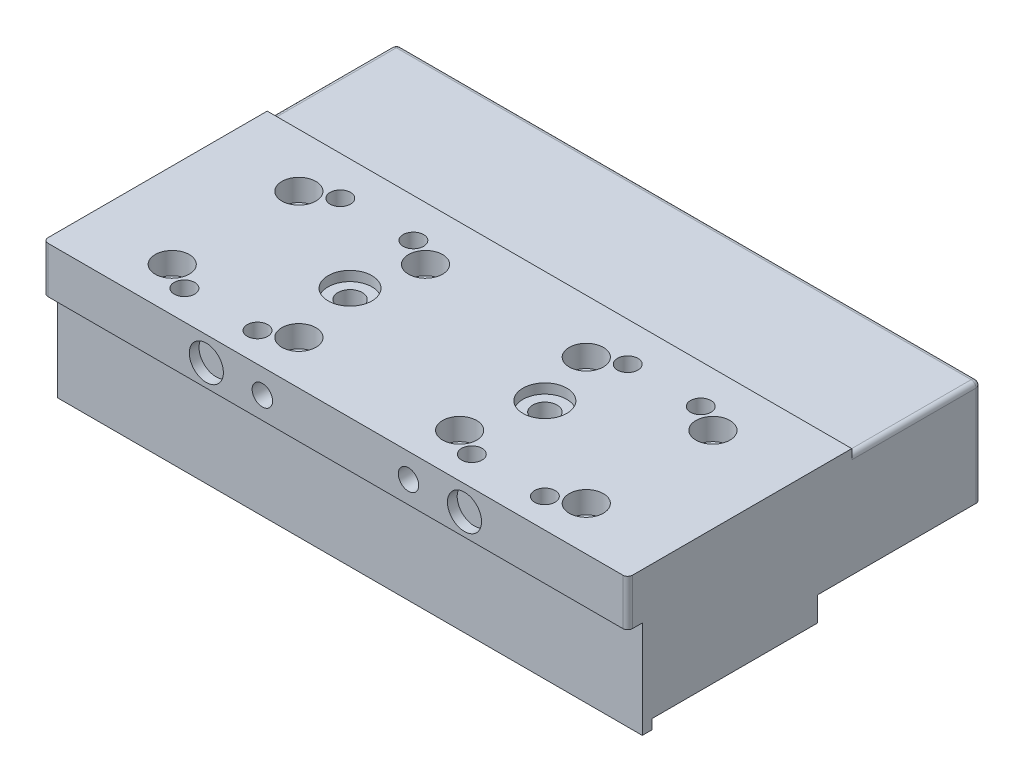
SolidWorks part; units mm, degrees
ref_plane "前视基准面" through (0, 0, 0) normal (0, 0, 1) x (1, 0, 0)
ref_plane "上视基准面" through (0, 0, 0) normal (0, 1, 0) x (1, 0, 0)
ref_plane "右视基准面" through (0, 0, 0) normal (1, 0, 0) x (0, 0, -1)
sketch "草图1" plane through (0, 0, 0) normal (0, 1, 0) x (1, 0, 0)
  line L1 (-60, 36.25) -> (60, 36.25)
  line L2 (-60, 36.25) -> (-60, -36.25)
  line L3 (-60, -36.25) -> (60, -36.25)
  line L4 (60, 36.25) -> (60, -36.25)
  line L5 (-60, 36.25) -> (60, -36.25) construction
  line L6 (-60, -36.25) -> (60, 36.25) construction
  point P0 (0, 0)
  dimension "D1" = 120
  dimension "D2" = 72.5
extrude "凸台-拉伸1" add sketch "草图1" along normal blind 22.5
sketch "草图2" plane through (0, 22.5, 0) normal (0, 1, 0) x (1, 0, 0)
  line L0 (60, -36.25) -> (60, 36.25) construction
  line L1 (-60, 36.25) -> (60, 36.25)
  line L2 (-60, 36.25) -> (-60, 9.75)
  line L3 (-60, 9.75) -> (60, 9.75)
  line L4 (60, 36.25) -> (60, 9.75)
  dimension "D1" = 26.5
extrude "切除-拉伸1" cut sketch "草图2" against normal blind 1
sketch "草图3" plane through (0, 0, 0) normal (0, -1, 0) x (1, 0, 0)
  line L0 (-60, -36.25) -> (-60, 36.25) construction
  line L1 (60, 36.25) -> (-60, 36.25)
  line L2 (60, 36.25) -> (60, -2.75)
  line L3 (60, -2.75) -> (-60, -2.75)
  line L4 (-60, 36.25) -> (-60, -2.75)
  dimension "D1" = 39
extrude "切除-拉伸2" cut sketch "草图3" against normal blind 13
sketch "草图4" plane through (-60, 0, 0) normal (-1, 0, 0) x (0, 0, 1)
  line L0 (-36.25, 21.5) -> (-9.75, 21.5) construction
  line L1 (-27.25, 3.3) -> (-25.35, 3.3)
  line L2 (-27.25, 3.3) -> (-27.25, 9.5)
  line L3 (-27.25, 9.5) -> (-8.25, 9.5)
  line L4 (-8.25, 3.3) -> (-8.25, 9.5)
  line L5 (-36.25, 21.5) -> (-36.25, 0) construction
  line L6 (-17.75, 3.5) -> (-17.75, -2.5913) construction
  line L7 (-36.25, 0) -> (-2.75, 0) construction
  line L8 (-25.35, 0) -> (-10.15, 0)
  line L9 (-25.35, 0) -> (-25.35, 3.3)
  line L11 (-10.15, 0) -> (-10.15, 3.3)
  line L12 (-10.15, 3.3) -> (-8.25, 3.3)
  dimension "D1" = 12
  dimension "D2" = 9
  dimension "D3" = 7.6
  dimension "D4" = 19
  dimension "D5" = 1.9
  dimension "D6" = 3.3
extrude "切除-拉伸3" [suppressed] cut sketch "草图4" against normal blind 30
sketch "草图36" plane through (-60, 0, 0) normal (-1, 0, 0) x (0, 0, 1)
  line L1 (-2.75, 13) -> (5.25, 13)
  line L2 (-2.75, 13) -> (-2.75, -5)
  line L3 (-2.75, -5) -> (5.25, -5)
  line L4 (5.25, 13) -> (5.25, -5)
  line L5 (36.25, 13) -> (-2.75, 13) construction
  line L6 (23.25, 13) -> (33.25, 13)
  line L7 (23.25, 13) -> (23.25, -5)
  line L8 (23.25, -5) -> (33.25, -5)
  line L10 (33.25, 13) -> (33.25, -5)
  dimension "D1" = 8
  dimension "D2" = 18
  dimension "D3" = 18
  dimension "D4" = 10
extrude "凸台-拉伸2" add sketch "草图36" against normal up to surface (120 mm away)
sketch "草图5" plane through (60, 0, 0) normal (1, 0, 0) x (0, 0, -1)
  line L0 (9.75, 21.5) -> (36.25, 21.5) construction
  line L1 (27.25, 9.5) -> (8.25, 9.5)
  line L2 (27.25, 9.5) -> (27.25, 3.3)
  line L3 (27.25, 3.3) -> (25.35, 3.3)
  line L4 (8.25, 9.5) -> (8.25, 3.3)
  line L5 (36.25, 21.5) -> (36.25, 0) construction
  line L7 (17.75, 3.5) -> (17.75, -3.6543) construction
  line L8 (2.75, 0) -> (36.25, 0) construction
  line L10 (25.35, 3.3) -> (25.35, 0)
  line L11 (25.35, 0) -> (10.15, 0)
  line L12 (10.15, 3.3) -> (10.15, 0)
  line L13 (10.15, 3.3) -> (8.25, 3.3)
  point P16 (26.3, 3.3)
  dimension "D1" = 3.3
  dimension "D2" = 19
  dimension "D3" = 12
  dimension "D4" = 9
  dimension "D5" = 7.6
  dimension "D6" = 1.9
  dimension "D7" = 1.9
extrude "切除-拉伸4" [suppressed] cut sketch "草图5" against normal blind 30
sketch "草图6" plane through (0, -5, 0) normal (0, -1, 0) x (1, 0, 0)
  line L0 (28.2, -27.15) -> (28.2, -2.15) construction
  line L1 (22.9, -27.15) -> (22.9, -2.15)
  line L2 (33.5, -27.15) -> (33.5, -2.15)
  line L3 (-28.2, -27.15) -> (-28.2, -2.15) construction
  line L4 (-33.5, -27.15) -> (-33.5, -2.15)
  line L5 (-22.9, -27.15) -> (-22.9, -2.15)
  line L6 (60, -36.25) -> (-60, -36.25) construction
  line L7 (60, -2.75) -> (60, -36.25) construction
  line L8 (-60, -36.25) -> (-60, -2.75) construction
  arc A0 (22.9, -27.15) -> (33.5, -27.15) centre (28.2, -27.15) ccw
  arc A1 (33.5, -2.15) -> (22.9, -2.15) centre (28.2, -2.15) ccw
  arc A2 (-33.5, -27.15) -> (-22.9, -27.15) centre (-28.2, -27.15) ccw
  arc A3 (-22.9, -2.15) -> (-33.5, -2.15) centre (-28.2, -2.15) ccw
  point P2 (28.2, -14.65)
  point P7 (-28.2, -14.65)
  dimension "D1" = 10.6
  dimension "D2" = 10.6
  dimension "D3" = 9.1
  dimension "D4" = 9.1
  dimension "D5" = 26.5
  dimension "D6" = 26.5
  dimension "D7" = 25
extrude "切除-拉伸5" [suppressed] cut sketch "草图6" against normal up to surface (14.5 mm away)
hole_wizard "打孔尺寸(%根据)内六角圆柱头螺钉的类型1" positions "草图7" profile "草图8" counterbore size "M4" standard "GB"
sketch "草图7" plane through (0, 22.5, 0) normal (0, 1, 0) x (1, 0, 0)
  line L0 (-60, -36.25) -> (60, -36.25) construction
  line L2 (0, -36.25) -> (0, 45.0705) construction
  point P0 (-42.5, -27.25)
  point P2 (-42.5, -1.25)
  point P4 (-16.5, -1.25)
  point P6 (-16.5, -27.25)
  point P8 (16.5, -1.25)
  point P10 (16.5, -27.25)
  point P12 (42.5, -27.25)
  point P14 (42.5, -1.25)
  dimension "D1" = 9
  dimension "D2" = 26
  dimension "D3" = 26
  dimension "D4" = 33
  dimension "D5" = 26
sketch "草图8" plane through (-42.5, 22.5, 27.25) normal (1, 0, 0) x (0, 0, 1)
  line L0 (0, 0) -> (0, 27.5)
  line L1 (0, 27.5) -> (2.25, 27.5)
  line L3 (2.25, 27.5) -> (2.25, 4.5)
  line L4 (2.25, 4.5) -> (3.5, 4.5)
  line L5 (3.5, 4.5) -> (3.5, 0)
  line L7 (3.5, 0) -> (0, 0)
  line L11 (0, -6.35) -> (0, 107.95) construction
  dimension "通孔孔直径" = 4.5
  dimension "通孔孔深度" = 27.5
  dimension "柱形沉头孔直径" = 7
  dimension "柱形沉头孔深度" = 4.5
hole_wizard "M4 螺纹孔1" positions "草图9" profile "草图10" tap size "M4" standard "GB"
sketch "草图9" plane through (0, 0, -36.25) normal (0, 0, -1) x (-1, 0, 0)
  line L0 (-60, 0) -> (60, 0) construction
  line L4 (0, 0) -> (0, 29.0588) construction
  line L5 (60, 22.5) -> (-60, 22.5) construction
  point P0 (-39, 6.5)
  point P2 (39, 6.5)
  dimension "D1" = 16
  dimension "D2" = 39
sketch "草图10" plane through (39, 6.5, -36.25) normal (1, 0, 0) x (0, 1, 0)
  line L0 (0, 0) -> (0, 11.9614)
  line L1 (0, 11.9614) -> (1.6, 11)
  line L2 (1.6, 11) -> (1.6, 0.425)
  line L3 (1.6, 0.425) -> (2.025, 0)
  line L5 (2.025, 0) -> (0, 0)
  line L6 (-1.6, 0.425) -> (-2.025, 0) construction
  line L10 (0, 11.9614) -> (-1.6, 11) construction
  line L11 (0, -6.35) -> (0, 107.95) construction
  dimension "螺纹孔钻头直径" = 3.2
  dimension "螺纹孔钻头深度" = 11
  dimension "近端锥形沉头孔直径" = 4.05
  dimension "近端锥形沉头孔角度" = 90
  dimension "导头角度" = 118
hole_wizard "M5 螺纹孔1" positions "草图11" profile "草图12" tap size "M5" standard "GB"
sketch "草图11" plane through (0, 0, -36.25) normal (0, 0, -1) x (-1, 0, 0)
  line L0 (-60, 21.5) -> (60, 21.5) construction
  line L1 (0, 21.5) -> (0, -5.4099) construction
  point P0 (-15, 17.5)
  point P2 (15, 17.5)
  dimension "D1" = 4
  dimension "D2" = 15
sketch "草图12" plane through (15, 17.5, -36.25) normal (1, 0, 0) x (0, 1, 0)
  line L0 (0, 0) -> (0, 15.7618)
  line L1 (0, 15.7618) -> (2.1, 14.5)
  line L2 (2.1, 14.5) -> (2.1, 0)
  line L5 (2.1, 0) -> (0, 0)
  line L10 (0, 15.7618) -> (-2.1, 14.5) construction
  line L11 (0, -6.35) -> (0, 107.95) construction
  dimension "螺纹孔钻头直径" = 4.2
  dimension "螺纹孔钻头深度" = 14.5
  dimension "导头角度" = 118
hole_wizard "M5 螺纹孔2" positions "草图15" profile "草图16" tap size "M5" standard "GB"
sketch "草图15" plane through (0, 22.5, 0) normal (0, 1, 0) x (1, 0, 0)
  line L0 (60, -36.25) -> (60, 9.75) construction
  line L1 (-60, -36.25) -> (60, -36.25) construction
  point P0 (-37, 1.75)
  point P2 (-22, 1.75)
  point P4 (22, 1.75)
  point P6 (37, 1.75)
  point P8 (37, -30.25)
  point P10 (22, -30.25)
  point P12 (-22, -30.25)
  point P14 (-37, -30.25)
  dimension "D1" = 23
  dimension "D2" = 6
  dimension "D3" = 32
  dimension "D4" = 15
  dimension "D5" = 44
  dimension "D6" = 15
sketch "草图16" plane through (-37, 22.5, -1.75) normal (1, 0, 0) x (0, 0, 1)
  line L0 (0, 0) -> (0, 11.2618)
  line L1 (0, 11.2618) -> (2.1, 10)
  line L2 (2.1, 10) -> (2.1, 0)
  line L5 (2.1, 0) -> (0, 0)
  line L10 (0, 11.2618) -> (-2.1, 10) construction
  line L11 (0, -6.35) -> (0, 107.95) construction
  dimension "螺纹孔钻头直径" = 4.2
  dimension "螺纹孔钻头深度" = 10
  dimension "导头角度" = 118
hole_wizard "M5 螺纹孔3" positions "草图19" profile "草图20" tap size "M5" standard "GB"
sketch "草图19" plane through (0, 0, 36.25) normal (0, 0, 1) x (1, 0, 0)
  line L0 (60, 13) -> (-60, 13) construction
  line L1 (0, 13) -> (0, 25.6962) construction
  point P0 (-15, 17.5)
  point P2 (15, 17.5)
  dimension "D1" = 4.5
  dimension "D2" = 15
sketch "草图20" plane through (-15, 17.5, 36.25) normal (1, 0, 0) x (0, -1, 0)
  line L0 (0, 0) -> (0, 5.7627)
  line L1 (0, 5.7627) -> (2.1, 5.2)
  line L2 (2.1, 5.2) -> (2.1, 0)
  line L5 (2.1, 0) -> (0, 0)
  line L10 (0, 5.7627) -> (-2.1, 5.2) construction
  line L11 (0, -6.35) -> (0, 107.95) construction
  dimension "螺纹孔钻头直径" = 4.2
  dimension "螺纹孔钻头深度" = 5.2
  dimension "导头角度" = 150
sketch "草图21" plane through (0, 0, 36.25) normal (0, 0, 1) x (1, 0, 0)
  line L0 (0, 13) -> (0, 27.1475) construction
  line L1 (60, 13) -> (-60, 13) construction
  circle A0 centre (-26.5, 17.5) radius 3.5
  circle A1 centre (26.5, 17.5) radius 3.5
  dimension "D1" = 53
  dimension "D3" = 7
  dimension "D2" = 26.5
extrude "切除-拉伸6" cut sketch "草图21" against normal blind 2
fillet "圆角1" radius 1 7 edges at (60, 10.75, -36.25) (60, 17.75, 36.25) (-60, 17.75, 36.25) (-60, 10.75, -36.25) (-60, 21.5, -23) (60, 21.5, -23) (0, 21.5, -36.25)
hole_wizard "M5 螺纹孔4" positions "草图22" profile "草图23" tap size "M5" standard "GB"
sketch "草图22" [suppressed] plane through (-22.9, 0, 0) normal (-1, 0, 0) x (0, 0, 1)
  line L1 (-27.15, 0) -> (-2.75, 0) construction
  line L3 (-17.75, 9.5) -> (-17.75, -9.4219) construction
  line L4 (-8.25, 9.5) -> (-27.25, 9.5) construction
  point P0 (-17.75, 3.5)
  dimension "D1" = 3.5
sketch "草图23" plane through (-22.9, 3.5, -17.75) normal (0, 1, 0) x (0, 0, 1)
  line L0 (0, 0) -> (0, 82.9)
  line L1 (0, 82.9) -> (2.1, 82.9)
  line L2 (2.1, 82.9) -> (2.1, 0)
  line L5 (2.1, 0) -> (0, 0)
  line L11 (0, -6.35) -> (0, 107.95) construction
  dimension "通孔螺纹孔钻头直径" = 4.2
  dimension "通孔螺纹孔钻头深度" = 82.9
sketch "草图31" plane through (0, 22.5, 0) normal (0, -1, 0) x (1, 0, 0)
  line L0 (0, 0) -> (0, 40.3044) construction
  line L1 (59, 36.25) -> (-59, 36.25) construction
  circle A0 centre (-20, 13.25) radius 4.5
  circle A1 centre (20, 13.25) radius 4.5
  dimension "D3" = 9
  dimension "D1" = 23
  dimension "D2" = 20
extrude "切除-拉伸7" cut sketch "草图31" along normal blind 2
hole_wizard "M6 螺纹孔1" positions "草图32" profile "草图33" tap size "M6" standard "GB"
sketch "草图32" plane through (0, 22.5, 0) normal (0, 1, 0) x (1, 0, 0)
  line L0 (0, 0) -> (0, -30.6645) construction
  line L2 (-59, -36.25) -> (59, -36.25) construction
  point P0 (20, -13.25)
  point P2 (-20, -13.25)
  dimension "D1" = 23
  dimension "D2" = 20
sketch "草图33" plane through (20, 22.5, 13.25) normal (1, 0, 0) x (0, 0, 1)
  line L0 (0, 0) -> (0, 9.5)
  line L1 (0, 9.5) -> (3.025, 9.5)
  line L2 (2.5, 8.975) -> (2.5, 0.525)
  line L3 (2.5, 0.525) -> (3.025, 0)
  line L5 (3.025, 0) -> (0, 0)
  line L6 (-2.5, 0.525) -> (-3.025, 0) construction
  line L7 (3.025, 9.5) -> (2.5, 8.975)
  line L8 (-3.025, 9.5) -> (-2.5, 8.975) construction
  line L11 (0, -6.35) -> (0, 107.95) construction
  dimension "通孔螺纹孔钻头直径" = 5
  dimension "通孔螺纹孔钻头深度" = 9.5
  dimension "近端锥形沉头孔直径" = 6.05
  dimension "近端锥形沉头孔角度" = 90
  dimension "远端锥形沉头孔直径" = 6.05
  dimension "远端锥形沉头孔角度" = 90
hole_wizard "M5 螺纹孔5" positions "草图34" profile "草图35" tap size "M5" standard "GB"
sketch "草图34" plane through (0, 0, -36.25) normal (0, 0, -1) x (-1, 0, 0)
  line L0 (59, 21.5) -> (-59, 21.5) construction
  line L1 (-60, 0) -> (-60, 20.5) construction
  point P0 (-3, 17.5)
  dimension "D1" = 4
  dimension "D2" = 57
sketch "草图35" plane through (3, 17.5, -36.25) normal (1, 0, 0) x (0, 1, 0)
  line L0 (0, 0) -> (0, 17.6618)
  line L1 (0, 17.6618) -> (2.1, 16.4)
  line L2 (2.1, 16.4) -> (2.1, 0)
  line L5 (2.1, 0) -> (0, 0)
  line L10 (0, 17.6618) -> (-2.1, 16.4) construction
  line L11 (0, -6.35) -> (0, 107.95) construction
  dimension "螺纹孔钻头直径" = 4.2
  dimension "螺纹孔钻头深度" = 16.4
  dimension "导头角度" = 118
sketch "草图37" plane through (-60, 0, 0) normal (-1, 0, 0) x (0, 0, 1)
  line L1 (33.25, -5) -> (31.25, -5)
  line L2 (33.25, -5) -> (33.25, -7)
  line L3 (33.25, -7) -> (31.25, -7)
  line L4 (31.25, -5) -> (31.25, -7)
  dimension "D1" = 2
  dimension "D2" = 2
extrude "凸台-拉伸3" add sketch "草图37" against normal up to surface (120 mm away)
sketch "草图38" plane through (-60, 0, 0) normal (-1, 0, 0) x (0, 0, 1)
  line L1 (5.25, 13) -> (23.25, 13)
  line L2 (5.25, 13) -> (5.25, -5)
  line L3 (5.25, -5) -> (23.25, -5)
  line L4 (23.25, 13) -> (23.25, -5)
extrude "凸台-拉伸4" add sketch "草图38" against normal up to surface (120 mm away)
